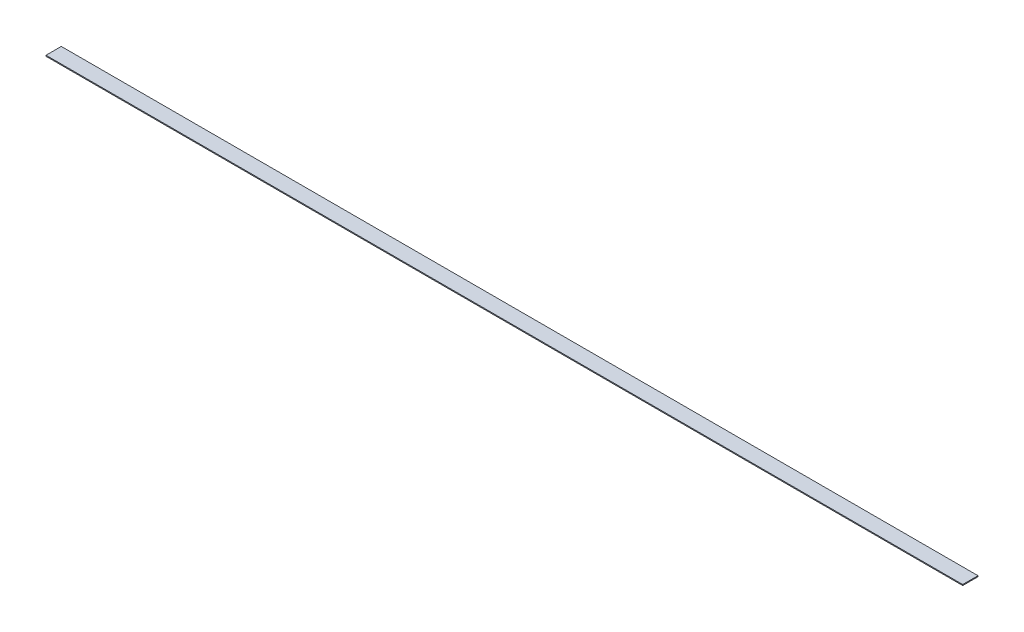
SolidWorks part; units mm, degrees
ref_plane "FRONT" through (0, 0, 0) normal (0, 0, 1) x (1, 0, 0)
ref_plane "TOP" through (0, 0, 0) normal (0, 1, 0) x (1, 0, 0)
ref_plane "RIGHT" through (0, 0, 0) normal (1, 0, 0) x (0, 0, -1)
sketch "Sketch1" plane through (0, 0, 0) normal (0, 1, 0) x (1, 0, 0)
  line L1 (-3048, 50.8) -> (3048, 50.8)
  line L2 (-3048, 50.8) -> (-3048, -50.8)
  line L3 (-3048, -50.8) -> (3048, -50.8)
  line L4 (3048, 50.8) -> (3048, -50.8)
  line L5 (-3048, 50.8) -> (3048, -50.8) construction
  line L6 (-3048, -50.8) -> (3048, 50.8) construction
  point P0 (0, 0)
  dimension "D1" = 6096
  dimension "D2" = 101.6
extrude "Boss-Extrude1" add sketch "Sketch1" along normal blind 6.35
